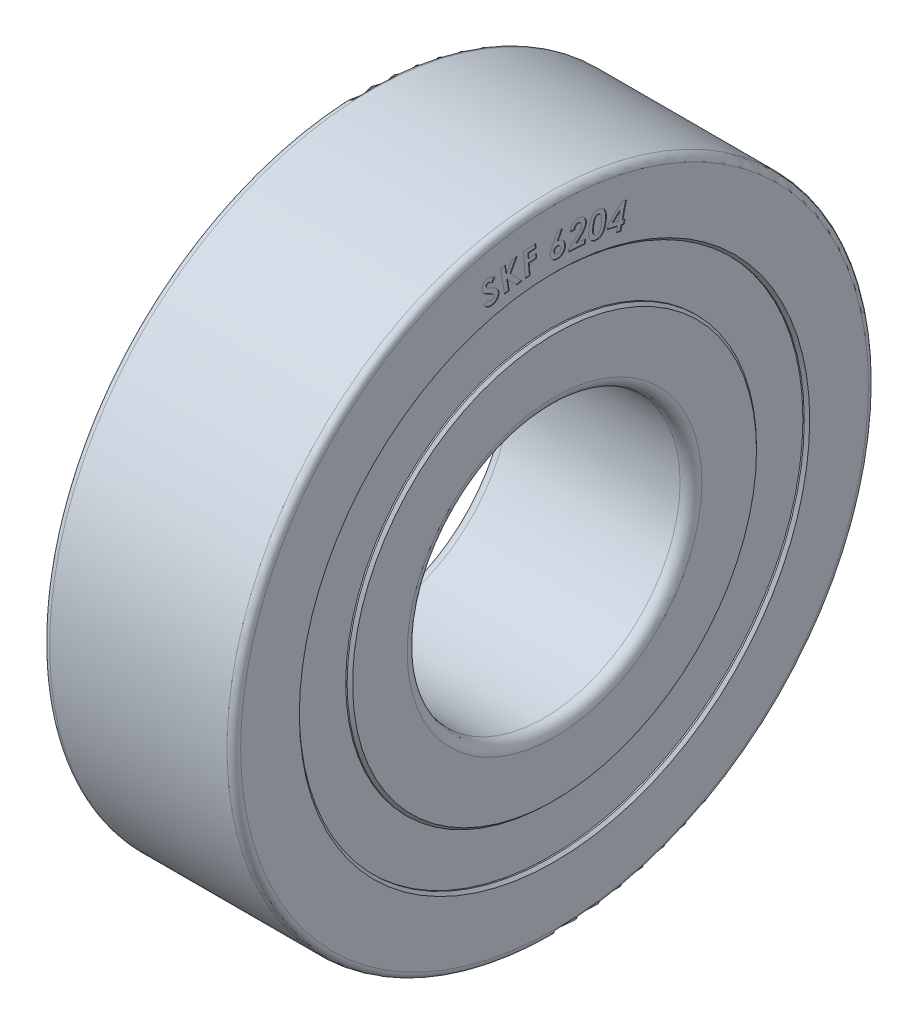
SolidWorks part; units mm, degrees
ref_plane "Front" through (0, 0, 0) normal (0, 0, 1) x (1, 0, 0)
ref_plane "Top" through (0, 0, 0) normal (0, 1, 0) x (1, 0, 0)
ref_plane "Right" through (0, 0, 0) normal (1, 0, 0) x (0, 0, -1)
sketch "Sketch1" plane through (0, 0, 0) normal (0, 0, 1) x (1, 0, 0)
  line L0 (0, 0) -> (-14, 0) construction
  line L1 (-13.8, 18.5) -> (-10.0311, 18.5)
  line L2 (-0.8, 10) -> (-13.2, 10)
  line L3 (0, 10.8) -> (0, 14.8)
  line L4 (-0.5, 23.5) -> (-13.5, 23.5)
  line L5 (-14, 10.8) -> (-14, 14.8)
  line L6 (-13.8, 15) -> (-10.0311, 15)
  line L7 (0, 18.7) -> (0, 23)
  line L8 (-3.9689, 15) -> (-0.2, 15)
  line L9 (-3.9689, 18.5) -> (-0.2, 18.5)
  line L10 (-14, 18.7) -> (-14, 23)
  line L11 (-14, 14.8) -> (-13.8, 15)
  line L12 (-14, 18.7) -> (-13.8, 18.5)
  line L13 (-0.2, 18.5) -> (0, 18.7)
  line L14 (0, 14.8) -> (-0.2, 15)
  arc A0 (-3.9689, 18.5) -> (-10.0311, 18.5) centre (-7, 16.75) ccw
  arc A1 (-10.0311, 15) -> (-3.9689, 15) centre (-7, 16.75) ccw
  arc A2 (-13.5, 23.5) -> (-14, 23) centre (-13.5, 23) ccw
  arc A3 (0, 23) -> (-0.5, 23.5) centre (-0.5, 23) ccw
  arc A4 (-13.2, 10) -> (-14, 10.8) centre (-13.2, 10.8) cw
  arc A5 (0, 10.8) -> (-0.8, 10) centre (-0.8, 10.8) cw
  point P10 (0, 15)
  point P13 (0, 18.5)
  point P16 (-14, 15)
  point P17 (-14, 18.5)
  point P18 (-14, 23.5)
  point P21 (0, 23.5)
  dimension "D4" = 7
  dimension "D11" = 0.5
  dimension "D12" = 0.8
  dimension "D1" = 10
  dimension "D2" = 23.5
  dimension "D3" = 14
  dimension "D5" = 7
  dimension "D6" = 6.75
  dimension "D7" = 16.75
  dimension "D8" = 3.5
  dimension "D9" = 5
  dimension "D10" = 5
revolve "Revolve1" add sketch "Sketch1" angle 360 about L0
sketch "Sketch2" plane through (0, 0, 0) normal (0, 0, 1) x (1, 0, 0)
  line L0 (-7, 20.25) -> (-7, 13.25)
  arc A0 (-7, 13.25) -> (-7, 20.25) centre (-7, 16.75) ccw
  dimension "D1" = 7
  dimension "D2" = 16.75
  dimension "D3" = 7
revolve "Revolve2" add sketch "Sketch2" angle 360 about L0
pattern_circular "CirPattern1" count 10 over 360 about axis through (0, 0, 0) along (1, 0, 0)
sketch "Sketch5" plane through (0, 0, 0) normal (1, 0, 0) x (0, 0, -1)
  line L0 (0, 0) -> (0, 19.5) construction
  line L1 (0, 0) -> (-9.75, 16.8875) construction
  line L2 (0, 0) -> (9.75, 16.8875) construction
  arc A0 (9.75, 16.8875) -> (-9.75, 16.8875) centre (0, 0) ccw construction
  text T0 "SKF 6204" font "Century Gothic" height 1.8
  dimension "D1" = 39
  dimension "D2" = 30
wrap "Wrap1" sketch "Sketch5" wrap type deboss source sketch "Sketch5" thickness 0.05 parameters "D1"=0.05
ref_plane "Plane1" through (-0.5, 0, 0) normal (1, 0, 0) x (0, 0, -1)
sketch "Sketch3" plane through (-0.5, 0, 0) normal (1, 0, 0) x (0, 0, -1)
  circle A0 centre (0, 0) radius 15
  circle A1 centre (0, 0) radius 18.5
  dimension "D1" = 37
  dimension "D2" = 30
extrude "Seal 1" add sketch "Sketch3" along normal blind 0.2
ref_plane "Plane2" through (-13.5, 0, 0) normal (-1, 0, 0) x (0, 0, 1)
sketch "Sketch4" plane through (-13.5, 0, 0) normal (-1, 0, 0) x (0, 0, 1)
  circle A0 centre (0, 0) radius 15
  circle A1 centre (0, 0) radius 18.5
  dimension "D1" = 37
  dimension "D2" = 30
extrude "Seal 2" add sketch "Sketch4" along normal blind 0.2
